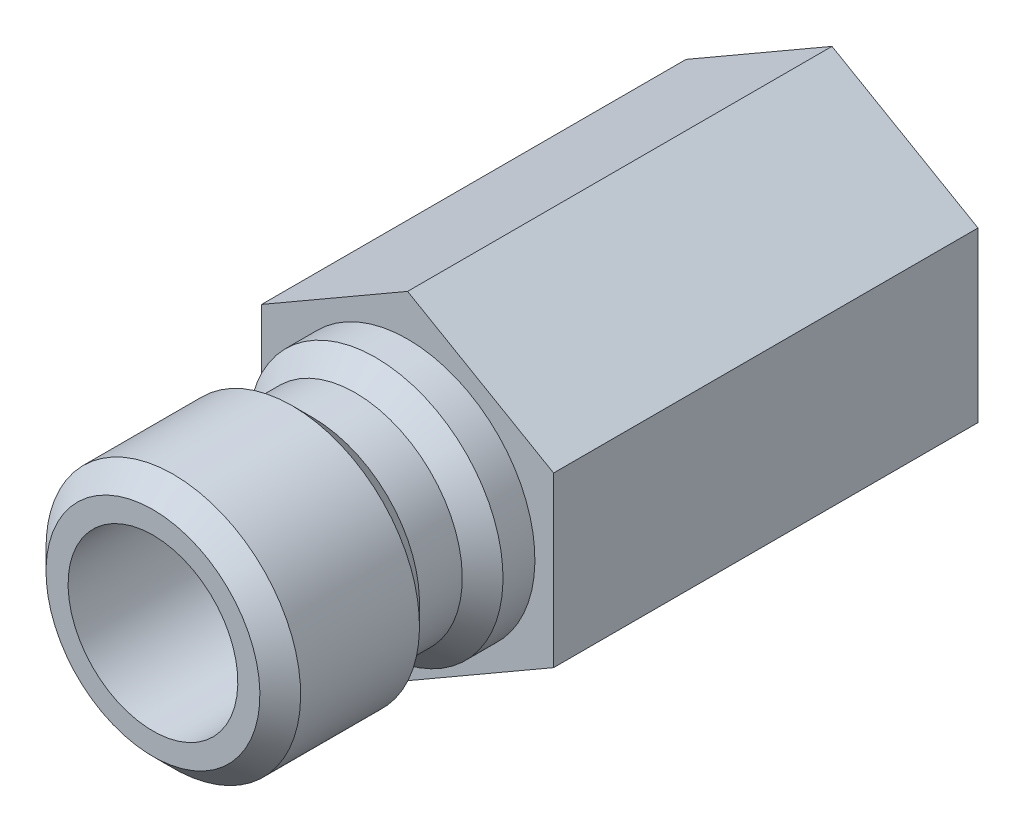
SolidWorks part; units mm, degrees
ref_plane "Front Plane" through (0, 0, 0) normal (0, 0, 1) x (1, 0, 0)
ref_plane "Top Plane" through (0, 0, 0) normal (0, 1, 0) x (1, 0, 0)
ref_plane "Right Plane" through (0, 0, 0) normal (1, 0, 0) x (0, 0, -1)
sketch "Sketch1" plane through (0, 0, 0) normal (1, 0, 0) x (0, 0, -1)
  line L0 (0, 0) -> (-12.7, 0) construction
  line L1 (-9.525, 3.175) -> (-9.525, 4.0005)
  line L2 (-3.556, 4.0005) -> (-3.556, 0) construction
  line L3 (-8.763, 4.7625) -> (-4.318, 4.7625)
  line L4 (0, 6.35) -> (0, 0) construction
  line L5 (-3.556, 4.0005) -> (-1.9558, 4.0005)
  line L6 (-1.1938, 4.7625) -> (0, 4.7625)
  line L7 (0, 4.7625) -> (0, 6.35)
  line L8 (-3.556, 4.0005) -> (-4.318, 4.7625)
  line L9 (-1.9558, 4.0005) -> (-1.1938, 4.7625)
  line L10 (-9.525, 4.0005) -> (-8.763, 4.7625)
  line L11 (-9.525, 3.175) -> (6.35, 3.175)
  line L12 (0, 6.35) -> (15.875, 6.35)
  line L13 (6.35, 3.175) -> (6.35, 4.3053)
  line L14 (15.875, 6.35) -> (15.875, 4.603)
  line L15 (6.35, 4.3053) -> (15.875, 4.603)
  dimension "D11" = 1.79
  dimension "D1" = 9.525
  dimension "D2" = 1.6002
  dimension "D3" = 0.762
  dimension "D4" = 45
  dimension "D5" = 5.969
  dimension "D6" = 45
  dimension "D7" = 12.7
  dimension "D8" = 8.6106
  dimension "D9" = 25.4
  dimension "D10" = 3.175
  dimension "D12" = 6.35
  dimension "D13" = 9.525
  dimension "D14" = 9.525
revolve "Revolve1" add sketch "Sketch1" angle 360 about L0
sketch "Sketch2" plane through (0, 0, 0) normal (0, 0, 1) x (1, 0, 0)
  line L1 (-5.461, 3.1529) -> (-5.461, -3.1529)
  line L2 (-5.461, -3.1529) -> (0, -6.3058)
  line L3 (0, -6.3058) -> (5.461, -3.1529)
  line L4 (5.461, -3.1529) -> (5.461, 3.1529)
  line L5 (5.461, 3.1529) -> (0, 6.3058)
  line L6 (0, 6.3058) -> (-5.461, 3.1529)
  circle A0 centre (0, 0) radius 5.461 construction
  dimension "D1" = 10.922
extrude "Cut-Extrude1" cut sketch "Sketch2" against normal through all flip side to cut
